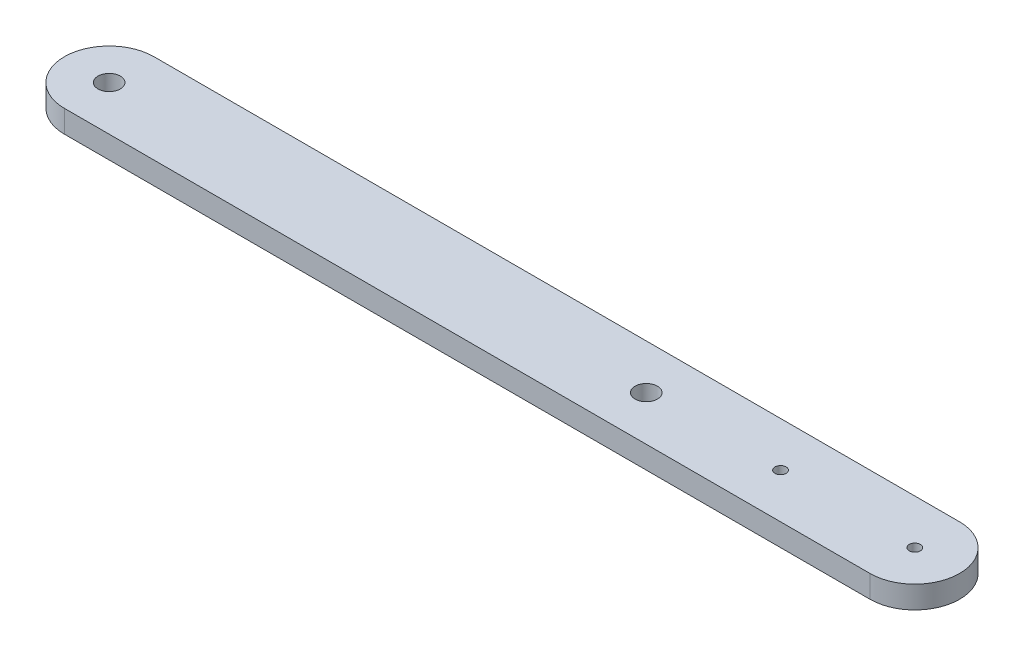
SolidWorks part; units mm, degrees
ref_plane "Front Plane" through (0, 0, 0) normal (0, 0, 1) x (1, 0, 0)
ref_plane "Top Plane" through (0, 0, 0) normal (0, 1, 0) x (1, 0, 0)
ref_plane "Right Plane" through (0, 0, 0) normal (1, 0, 0) x (0, 0, -1)
sketch "Sketch1" plane through (0, 0, 0) normal (0, 1, 0) x (1, 0, 0)
  line L0 (0, 12.7) -> (228.6, 12.7)
  line L1 (0, -12.7) -> (228.6, -12.7)
  circle A0 centre (0, 0) radius 3.175
  circle A1 centre (0, 0) radius 12.7
  circle A2 centre (228.6, 0) radius 12.7
  circle A3 centre (228.6, 0) radius 1.5875
  point P10 (125.4514, -32.4721)
  dimension "D1" = 6.35
  dimension "D2" = 25.4
  dimension "D3" = 228.6
  dimension "D4" = 25.4
  dimension "D5" = 3.175
  dimension "D6" = 228.6
  dimension "D7" = 12.7
extrude "Boss-Extrude1" add sketch "Sketch1" along normal blind 6.35 contours A1 A0 | A2 L0 A1 L1 | A2 A3
sketch "Sketch2" plane through (0, 6.35, 0) normal (0, 1, 0) x (1, 0, 0)
  circle A0 centre (152.4, 0) radius 3.175
  circle A1 centre (190.5, 0) radius 1.5875
  circle A2 centre (228.6, 0) radius 1.5875 construction
  point P7 (193.7805, 15.4665)
  point P9 (206.714, -24.7579)
  point P12 (199.3086, -8.8361)
  dimension "D1" = 152.4
  dimension "D2" = 6.35
  dimension "D4" = 3.175
  dimension "D5" = 38.1
  dimension "D6" = 0
  dimension "D3" = 0
extrude "Cut-Extrude1" cut sketch "Sketch2" against normal blind 6.35
